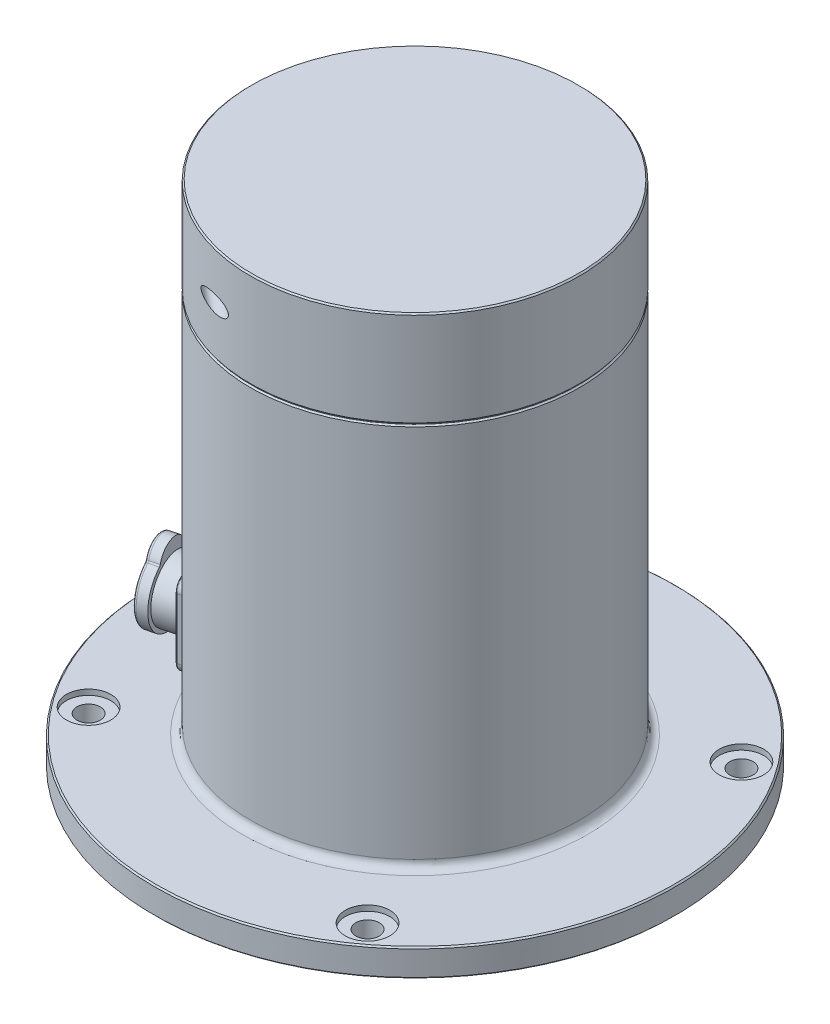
SolidWorks part; units mm, degrees
ref_plane "前视基准面" through (0, 0, 0) normal (0, 0, 1) x (1, 0, 0)
ref_plane "上视基准面" through (0, 0, 0) normal (0, 1, 0) x (1, 0, 0)
ref_plane "右视基准面" through (0, 0, 0) normal (1, 0, 0) x (0, 0, -1)
imported_body "消除特征3"
imported_body "消除特征4"
other "移动面1" parameters "D1"=1
ref_plane "基准面1" through (-123.3072, 0, -17.9325) normal (-0.9896, 0, -0.1439) x (0, 1, 0)
